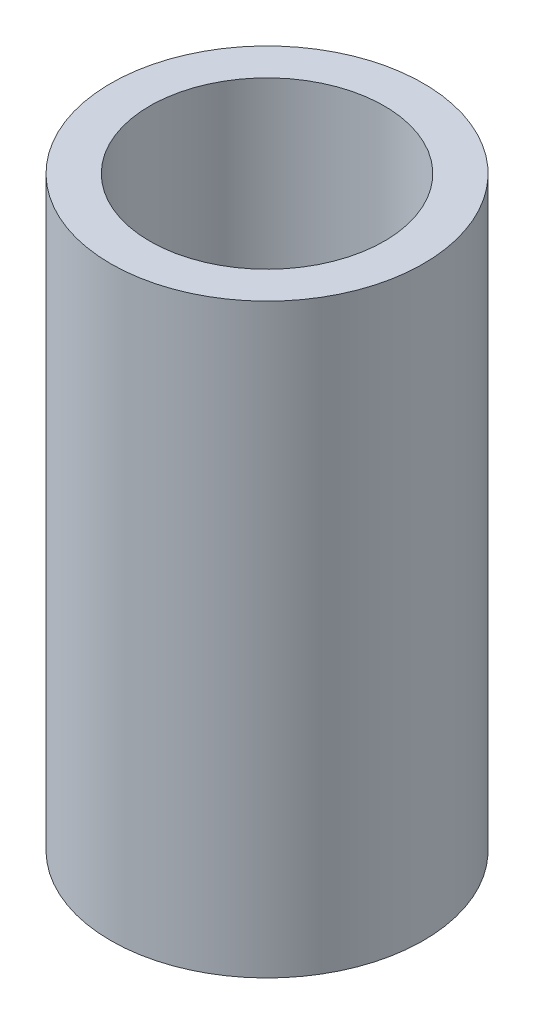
SolidWorks part; units mm, degrees
ref_plane "Front Plane" through (0, 0, 0) normal (0, 0, 1) x (1, 0, 0)
ref_plane "Top Plane" through (0, 0, 0) normal (0, 1, 0) x (1, 0, 0)
ref_plane "Right Plane" through (0, 0, 0) normal (1, 0, 0) x (0, 0, -1)
sketch "Sketch1" plane through (0, 0, 0) normal (0, 1, 0) x (1, 0, 0)
  circle A0 centre (0, 0) radius 1.5
  circle A1 centre (0, 0) radius 2
  dimension "D1" = 3
  dimension "D2" = 4
extrude "Boss-Extrude1" add sketch "Sketch1" along normal blind 7.5
sketch "Sketch2" plane through (0, 0, 0) normal (0, -1, 0) x (1, 0, 0)
  line L0 (0, 0) -> (0, 2) construction
  circle A0 centre (0, 0) radius 2 construction
